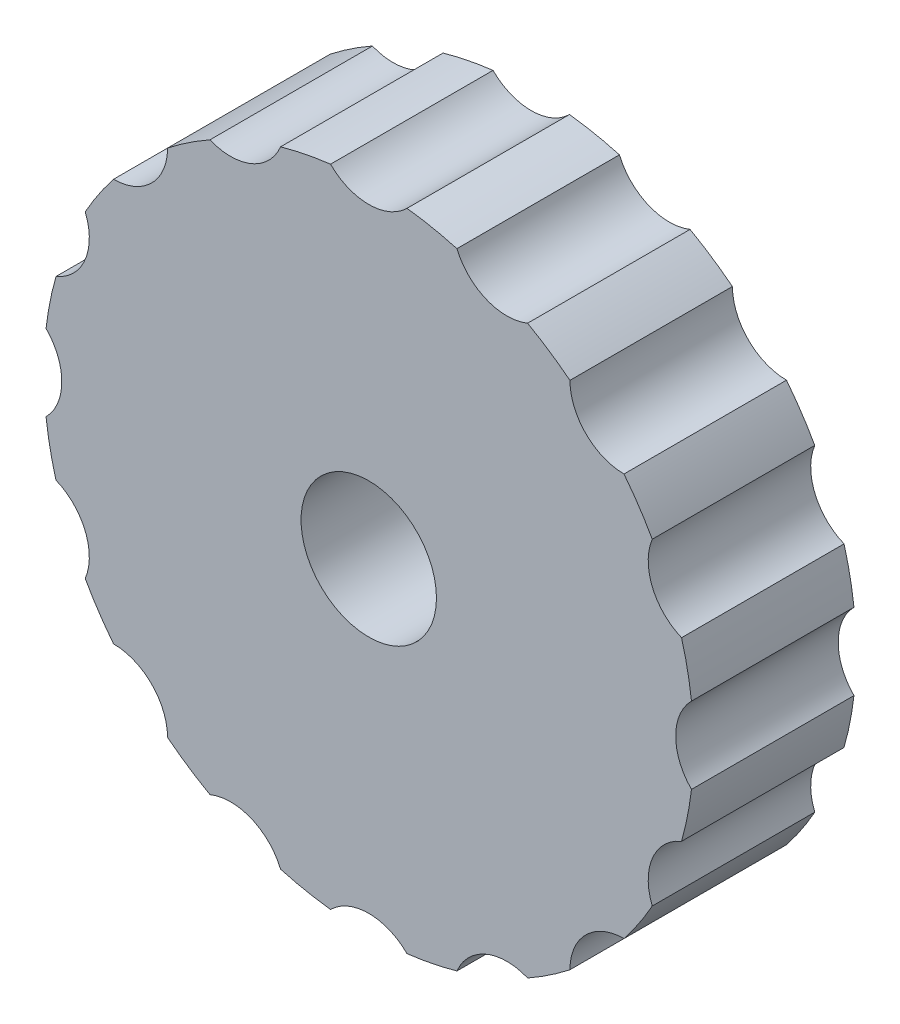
SolidWorks part; units mm, degrees
ref_plane "Front" through (0, 0, 0) normal (0, 0, 1) x (1, 0, 0)
ref_plane "Top" through (0, 0, 0) normal (0, 1, 0) x (1, 0, 0)
ref_plane "Right" through (0, 0, 0) normal (1, 0, 0) x (0, 0, -1)
sketch "Sketch1" plane through (0, 0, 0) normal (0, 0, 1) x (1, 0, 0)
  circle A0 centre (0, 0) radius 18
  dimension "D1" = 36
extrude "Boss-Extrude1" add sketch "Sketch1" along normal blind 9
sketch "Sketch2" plane through (0, 0, 9) normal (0, 0, 1) x (1, 0, 0)
  circle A0 centre (0, 0) radius 3.75
  dimension "D1" = 7.5
extrude "Cut-Extrude1" cut sketch "Sketch2" against normal blind 7
sketch "Sketch3" plane through (0, 0, 9) normal (0, 0, 1) x (1, 0, 0)
  line L0 (0, 0) -> (0, 25.6335) construction
  circle A0 centre (0, 20) radius 3
  dimension "D2" = 6
  dimension "D1" = 20
extrude "Cut-Extrude2" cut sketch "Sketch3" against normal up to next
pattern_circular "CirPattern1" count 16 over 360 about axis through (0, 0, 0) along (0, 0, 1) of "Cut-Extrude2"
